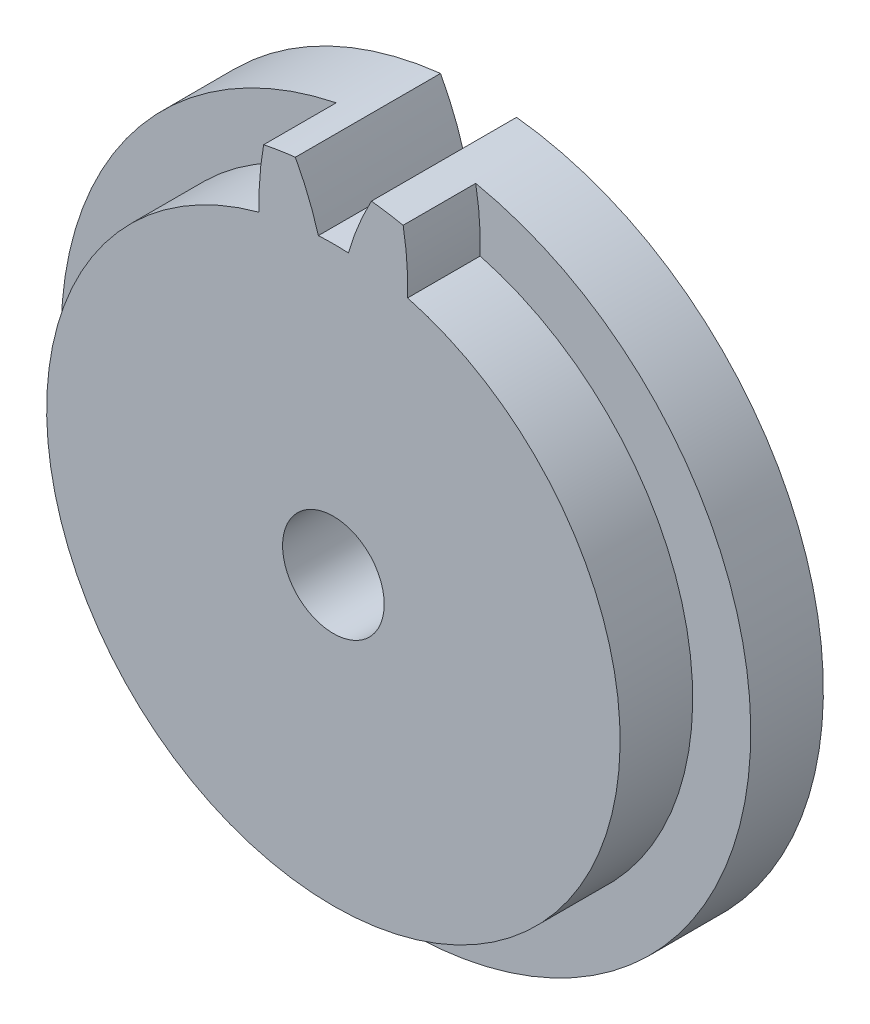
SolidWorks part; units mm, degrees
ref_plane "前基準面" through (0, 0, 0) normal (0, 0, 1) x (1, 0, 0)
ref_plane "上基準面" through (0, 0, 0) normal (0, 1, 0) x (1, 0, 0)
ref_plane "右基準面" through (0, 0, 0) normal (1, 0, 0) x (0, 0, -1)
sketch "草圖1" plane through (0, 0, 0) normal (0, 0, 1) x (1, 0, 0)
  line L0 (0, -15.5) -> (-7.8217, 33.8844) construction
  line L1 (0, -15.5) -> (7.8217, 33.8844) construction
  line L2 (0, -15.5) -> (0, 34.5) construction
  line L3 (0, -15.5) -> (-2.0673, 23.9459) construction
  line L4 (0, -15.5) -> (2.0673, 23.9459) construction
  line L5 (0, 47.5) -> (-6.8883, 30.8702) construction
  line L7 (0, 47.5) -> (6.8883, 30.8702) construction
  line L8 (0, 47.5) -> (-3.4455, 35.4842) construction
  line L9 (0, 47.5) -> (3.4455, 35.4842) construction
  line L10 (-1.625, 24.5) -> (1.625, 24.5)
  circle A0 centre (0, -15.5) radius 39.5
  circle A1 centre (0, -15.5) radius 45 construction
  arc A2 (-21.5968, 29.5952) -> (-23.7885, 28.4785) centre (0, -15.5) ccw
  circle A3 centre (0, -15.5) radius 7
  arc A4 (-6.6046, 34.0619) -> (-2.0673, 23.9459) centre (-40.3648, 12.8439) cw
  arc A5 (6.6046, 34.0619) -> (2.0673, 23.9459) centre (40.3648, 12.8439) ccw
  circle A6 centre (0, 47.5) radius 5
  circle A7 centre (0, 47.5) radius 12.5
  circle A8 centre (0, 47.5) radius 18 construction
  arc A9 (-3.4455, 35.4842) -> (-1.625, 24.5) centre (29.8672, 35.3623) ccw
  arc A10 (3.4455, 35.4842) -> (1.625, 24.5) centre (-29.8672, 35.3623) cw
  arc A11 (-21.5968, 29.5952) -> (-14.1555, 21.3764) centre (-47.1479, -1.0167) cw
  arc A12 (-9.0341, 33.6771) -> (-10.2234, 22.6541) centre (29.6304, 23.93) ccw
  arc A13 (-34.475, 20.7143) -> (-24.8582, 15.1973) centre (-49.3159, -16.2951) cw
  arc A14 (-23.7885, 28.4785) -> (-21.5132, 17.6275) centre (15.9956, 31.1565) ccw
  arc A15 (-43.9785, 8.2885) -> (-33.1275, 6.0132) centre (-46.6565, -31.4956) cw
  arc A16 (-36.2143, 18.975) -> (-30.6973, 9.3582) centre (0.7951, 33.8159) ccw
  arc A17 (-49.1771, -6.4659) -> (-38.1541, -5.2766) centre (-39.43, -45.1304) cw
  arc A18 (-45.0952, 6.0968) -> (-36.8764, -1.3445) centre (-14.4833, 31.6479) ccw
  arc A19 (-49.5619, -22.1046) -> (-39.4459, -17.5673) centre (-28.3439, -55.8648) cw
  arc A20 (-49.5619, -8.8954) -> (-39.4459, -13.4327) centre (-28.3439, 24.8648) ccw
  arc A21 (-45.0952, -37.0968) -> (-36.8764, -29.6555) centre (-14.4833, -62.6479) cw
  arc A22 (-49.1771, -24.5341) -> (-38.1541, -25.7234) centre (-39.43, 14.1304) ccw
  arc A23 (-36.2143, -49.975) -> (-30.6973, -40.3582) centre (0.7951, -64.8159) cw
  arc A24 (-43.9785, -39.2885) -> (-33.1275, -37.0132) centre (-46.6565, 0.4956) ccw
  arc A25 (-23.7885, -59.4785) -> (-21.5132, -48.6275) centre (15.9956, -62.1565) cw
  arc A26 (-34.475, -51.7143) -> (-24.8582, -46.1973) centre (-49.3159, -14.7049) ccw
  arc A27 (-9.0341, -64.6771) -> (-10.2234, -53.6541) centre (29.6304, -54.93) cw
  arc A28 (-21.5968, -60.5952) -> (-14.1555, -52.3764) centre (-47.1479, -29.9833) ccw
  arc A29 (6.6046, -65.0619) -> (2.0673, -54.9459) centre (40.3648, -43.8439) cw
  arc A30 (-6.6046, -65.0619) -> (-2.0673, -54.9459) centre (-40.3648, -43.8439) ccw
  arc A31 (21.5968, -60.5952) -> (14.1555, -52.3764) centre (47.1479, -29.9833) cw
  arc A32 (9.0341, -64.6771) -> (10.2234, -53.6541) centre (-29.6304, -54.93) ccw
  arc A33 (34.475, -51.7143) -> (24.8582, -46.1973) centre (49.3159, -14.7049) cw
  arc A34 (23.7885, -59.4785) -> (21.5132, -48.6275) centre (-15.9956, -62.1565) ccw
  arc A35 (43.9785, -39.2885) -> (33.1275, -37.0132) centre (46.6565, 0.4956) cw
  arc A36 (36.2143, -49.975) -> (30.6973, -40.3582) centre (-0.7951, -64.8159) ccw
  arc A37 (49.1771, -24.5341) -> (38.1541, -25.7234) centre (39.43, 14.1304) cw
  arc A38 (45.0952, -37.0968) -> (36.8764, -29.6555) centre (14.4833, -62.6479) ccw
  arc A39 (49.5619, -8.8954) -> (39.4459, -13.4327) centre (28.3439, 24.8648) cw
  arc A40 (49.5619, -22.1046) -> (39.4459, -17.5673) centre (28.3439, -55.8648) ccw
  arc A41 (45.0952, 6.0968) -> (36.8764, -1.3445) centre (14.4833, 31.6479) cw
  arc A42 (49.1771, -6.4659) -> (38.1541, -5.2766) centre (39.43, -45.1304) ccw
  arc A43 (36.2143, 18.975) -> (30.6973, 9.3582) centre (-0.7951, 33.8159) cw
  arc A44 (43.9785, 8.2885) -> (33.1275, 6.0132) centre (46.6565, -31.4956) ccw
  arc A45 (23.7885, 28.4785) -> (21.5132, 17.6275) centre (-15.9956, 31.1565) cw
  arc A46 (34.475, 20.7143) -> (24.8582, 15.1973) centre (49.3159, -16.2951) ccw
  arc A47 (9.0341, 33.6771) -> (10.2234, 22.6541) centre (-29.6304, 23.93) cw
  arc A48 (21.5968, 29.5952) -> (14.1555, 21.3764) centre (47.1479, -1.0167) ccw
  arc A49 (-6.6046, 34.0619) -> (-9.0341, 33.6771) centre (0, -15.5) ccw
  arc A50 (9.0341, 33.6771) -> (6.6046, 34.0619) centre (0, -15.5) ccw
  arc A51 (23.7885, 28.4785) -> (21.5968, 29.5952) centre (0, -15.5) ccw
  arc A52 (36.2143, 18.975) -> (34.475, 20.7143) centre (0, -15.5) ccw
  arc A53 (45.0952, 6.0968) -> (43.9785, 8.2885) centre (0, -15.5) ccw
  arc A54 (49.5619, -8.8954) -> (49.1771, -6.4659) centre (0, -15.5) ccw
  arc A55 (49.1771, -24.5341) -> (49.5619, -22.1046) centre (0, -15.5) ccw
  arc A56 (43.9785, -39.2885) -> (45.0952, -37.0968) centre (0, -15.5) ccw
  arc A57 (34.475, -51.7143) -> (36.2143, -49.975) centre (0, -15.5) ccw
  arc A58 (21.5968, -60.5952) -> (23.7885, -59.4785) centre (0, -15.5) ccw
  arc A59 (6.6046, -65.0619) -> (9.0341, -64.6771) centre (0, -15.5) ccw
  arc A60 (-9.0341, -64.6771) -> (-6.6046, -65.0619) centre (0, -15.5) ccw
  arc A61 (-23.7885, -59.4785) -> (-21.5968, -60.5952) centre (0, -15.5) ccw
  arc A62 (-36.2143, -49.975) -> (-34.475, -51.7143) centre (0, -15.5) ccw
  arc A63 (-45.0952, -37.0968) -> (-43.9785, -39.2885) centre (0, -15.5) ccw
  arc A64 (-49.5619, -22.1046) -> (-49.1771, -24.5341) centre (0, -15.5) ccw
  arc A65 (-49.1771, -6.4659) -> (-49.5619, -8.8954) centre (0, -15.5) ccw
  arc A66 (-34.475, 20.7143) -> (-36.2143, 18.975) centre (0, -15.5) ccw
  arc A67 (-43.9785, 8.2885) -> (-45.0952, 6.0968) centre (0, -15.5) ccw
  point P18 (0, 24.5)
  point P144 (0, -15.5)
  dimension "D1" = 79
  dimension "D2" = 90
  dimension "D3" = 100
  dimension "D6" = 14
  dimension "D9" = 25
  dimension "D10" = 10
  dimension "D15" = 33.3129
  dimension "D16" = 39.8742
  dimension "D4" = 18
  dimension "D5" = 6
  dimension "D7" = 1.23
  dimension "D8" = 63
  dimension "D11" = 45
  dimension "D12" = 32
  dimension "D13" = 3.25
  dimension "D14" = 23
  dimension "D17" = 20
extrude "填料-伸長1" add sketch "草圖1" along normal blind 10 contours A0 A3 | A13 A66 A16 A0 | A2 A14 A0 A11 | A4 A49 A12 A0 | A47 A50 A5 A0 | A45 A51 A48 A0 | A43 A52 A46 A0 | A41 A53 A44 A0 | A39 A54 A42 A0 | A37 A55 A40 A0 | A35 A56 A38 A0 | A33 A57 A36 A0 | A31 A58 A34 A0 | A29 A59 A32 A0 | A27 A60 A30 A0 | A25 A61 A28 A0 | A23 A62 A26 A0 | A21 A63 A24 A0 | A19 A64 A22 A0 | A17 A65 A20 A0 | A15 A67 A18 A0
sketch "草圖2" plane through (0, 0, 0) normal (0, 0, 1) x (1, 0, 0)
  arc A0 (6.6046, 34.0619) -> (2.0673, 23.9459) centre (40.3648, 12.8439) ccw construction
  arc A1 (2.0673, 23.9459) -> (-2.0673, 23.9459) centre (0, -15.5) ccw construction
  arc A2 (-2.0673, 23.9459) -> (-6.6046, 34.0619) centre (-40.3648, 12.8439) ccw construction
  arc A3 (6.6046, 34.0619) -> (2.0673, 23.9459) centre (40.3648, 12.8439) ccw
  arc A4 (2.0673, 23.9459) -> (-2.0673, 23.9459) centre (0, -15.5) ccw
  arc A5 (-2.0673, 23.9459) -> (-6.6046, 34.0619) centre (-40.3648, 12.8439) ccw
  arc A6 (-6.6046, 34.0619) -> (6.6046, 34.0619) centre (0, -15.5) ccw
  circle A7 centre (0, -15.5) radius 7 construction
  circle A8 centre (0, -15.5) radius 7
extrude "填料-伸長2" add sketch "草圖2" against normal blind 10
sketch "草圖3" plane through (0, 0, 0) normal (0, 0, 1) x (1, 0, 0)
  circle A0 centre (0, -15.5) radius 39.5
  arc A80 (39.4459, -17.5673) -> (39.4459, -13.4327) centre (0, -15.5) ccw
  arc A81 (39.4459, -13.4327) -> (49.5619, -8.8954) centre (28.3439, 24.8648) ccw
  arc A82 (49.5619, -8.8954) -> (49.1771, -6.4659) centre (0, -15.5) ccw
  arc A83 (49.1771, -6.4659) -> (38.1541, -5.2766) centre (39.43, -45.1304) ccw
  arc A84 (38.1541, -5.2766) -> (36.8764, -1.3445) centre (0, -15.5) ccw
  arc A85 (36.8764, -1.3445) -> (45.0952, 6.0968) centre (14.4833, 31.6479) ccw
  arc A86 (45.0952, 6.0968) -> (43.9785, 8.2885) centre (0, -15.5) ccw
  arc A87 (43.9785, 8.2885) -> (33.1275, 6.0132) centre (46.6565, -31.4956) ccw
  arc A88 (33.1275, 6.0132) -> (30.6973, 9.3582) centre (0, -15.5) ccw
  arc A89 (30.6973, 9.3582) -> (36.2143, 18.975) centre (-0.7951, 33.8159) ccw
  arc A90 (36.2143, 18.975) -> (34.475, 20.7143) centre (0, -15.5) ccw
  arc A91 (34.475, 20.7143) -> (24.8582, 15.1973) centre (49.3159, -16.2951) ccw
  arc A92 (24.8582, 15.1973) -> (21.5132, 17.6275) centre (0, -15.5) ccw
  arc A93 (21.5132, 17.6275) -> (23.7885, 28.4785) centre (-15.9956, 31.1565) ccw
  arc A94 (23.7885, 28.4785) -> (21.5968, 29.5952) centre (0, -15.5) ccw
  arc A95 (21.5968, 29.5952) -> (14.1555, 21.3764) centre (47.1479, -1.0167) ccw
  arc A96 (14.1555, 21.3764) -> (10.2234, 22.6541) centre (0, -15.5) ccw
  arc A97 (10.2234, 22.6541) -> (9.0341, 33.6771) centre (-29.6304, 23.93) ccw
  arc A98 (9.0341, 33.6771) -> (6.6046, 34.0619) centre (0, -15.5) ccw
  arc A99 (6.6046, 34.0619) -> (2.0673, 23.9459) centre (40.3648, 12.8439) ccw
  arc A100 (2.0673, 23.9459) -> (-2.0673, 23.9459) centre (0, -15.5) ccw
  arc A101 (-2.0673, 23.9459) -> (-6.6046, 34.0619) centre (-40.3648, 12.8439) ccw
  arc A102 (-6.6046, 34.0619) -> (-9.0341, 33.6771) centre (0, -15.5) ccw
  arc A103 (-9.0341, 33.6771) -> (-10.2234, 22.6541) centre (29.6304, 23.93) ccw
  arc A104 (-10.2234, 22.6541) -> (-14.1555, 21.3764) centre (0, -15.5) ccw
  arc A105 (-14.1555, 21.3764) -> (-21.5968, 29.5952) centre (-47.1479, -1.0167) ccw
  arc A106 (-21.5968, 29.5952) -> (-23.7885, 28.4785) centre (0, -15.5) ccw
  arc A107 (-23.7885, 28.4785) -> (-21.5132, 17.6275) centre (15.9956, 31.1565) ccw
  arc A108 (-21.5132, 17.6275) -> (-24.8582, 15.1973) centre (0, -15.5) ccw
  arc A109 (-24.8582, 15.1973) -> (-34.475, 20.7143) centre (-49.3159, -16.2951) ccw
  arc A110 (-34.475, 20.7143) -> (-36.2143, 18.975) centre (0, -15.5) ccw
  arc A111 (-36.2143, 18.975) -> (-30.6973, 9.3582) centre (0.7951, 33.8159) ccw
  arc A112 (-30.6973, 9.3582) -> (-33.1275, 6.0132) centre (0, -15.5) ccw
  arc A113 (-33.1275, 6.0132) -> (-43.9785, 8.2885) centre (-46.6565, -31.4956) ccw
  arc A114 (-43.9785, 8.2885) -> (-45.0952, 6.0968) centre (0, -15.5) ccw
  arc A115 (-45.0952, 6.0968) -> (-36.8764, -1.3445) centre (-14.4833, 31.6479) ccw
  arc A116 (-36.8764, -1.3445) -> (-38.1541, -5.2766) centre (0, -15.5) ccw
  arc A117 (-38.1541, -5.2766) -> (-49.1771, -6.4659) centre (-39.43, -45.1304) ccw
  arc A118 (-49.1771, -6.4659) -> (-49.5619, -8.8954) centre (0, -15.5) ccw
  arc A119 (-49.5619, -8.8954) -> (-39.4459, -13.4327) centre (-28.3439, 24.8648) ccw
  arc A120 (-39.4459, -13.4327) -> (-39.4459, -17.5673) centre (0, -15.5) ccw
  arc A121 (-39.4459, -17.5673) -> (-49.5619, -22.1046) centre (-28.3439, -55.8648) ccw
  arc A122 (-49.5619, -22.1046) -> (-49.1771, -24.5341) centre (0, -15.5) ccw
  arc A123 (-49.1771, -24.5341) -> (-38.1541, -25.7234) centre (-39.43, 14.1304) ccw
  arc A124 (-38.1541, -25.7234) -> (-36.8764, -29.6555) centre (0, -15.5) ccw
  arc A125 (-36.8764, -29.6555) -> (-45.0952, -37.0968) centre (-14.4833, -62.6479) ccw
  arc A126 (-45.0952, -37.0968) -> (-43.9785, -39.2885) centre (0, -15.5) ccw
  arc A127 (-43.9785, -39.2885) -> (-33.1275, -37.0132) centre (-46.6565, 0.4956) ccw
  arc A128 (-33.1275, -37.0132) -> (-30.6973, -40.3582) centre (0, -15.5) ccw
  arc A129 (-30.6973, -40.3582) -> (-36.2143, -49.975) centre (0.7951, -64.8159) ccw
  arc A130 (-36.2143, -49.975) -> (-34.475, -51.7143) centre (0, -15.5) ccw
  arc A131 (-34.475, -51.7143) -> (-24.8582, -46.1973) centre (-49.3159, -14.7049) ccw
  arc A132 (-24.8582, -46.1973) -> (-21.5132, -48.6275) centre (0, -15.5) ccw
  arc A133 (-21.5132, -48.6275) -> (-23.7885, -59.4785) centre (15.9956, -62.1565) ccw
  arc A134 (-23.7885, -59.4785) -> (-21.5968, -60.5952) centre (0, -15.5) ccw
  arc A135 (-21.5968, -60.5952) -> (-14.1555, -52.3764) centre (-47.1479, -29.9833) ccw
  arc A136 (-14.1555, -52.3764) -> (-10.2234, -53.6541) centre (0, -15.5) ccw
  arc A137 (-10.2234, -53.6541) -> (-9.0341, -64.6771) centre (29.6304, -54.93) ccw
  arc A138 (-9.0341, -64.6771) -> (-6.6046, -65.0619) centre (0, -15.5) ccw
  arc A139 (-6.6046, -65.0619) -> (-2.0673, -54.9459) centre (-40.3648, -43.8439) ccw
  arc A140 (-2.0673, -54.9459) -> (2.0673, -54.9459) centre (0, -15.5) ccw
  arc A141 (2.0673, -54.9459) -> (6.6046, -65.0619) centre (40.3648, -43.8439) ccw
  arc A142 (6.6046, -65.0619) -> (9.0341, -64.6771) centre (0, -15.5) ccw
  arc A143 (9.0341, -64.6771) -> (10.2234, -53.6541) centre (-29.6304, -54.93) ccw
  arc A144 (10.2234, -53.6541) -> (14.1555, -52.3764) centre (0, -15.5) ccw
  arc A145 (14.1555, -52.3764) -> (21.5968, -60.5952) centre (47.1479, -29.9833) ccw
  arc A146 (21.5968, -60.5952) -> (23.7885, -59.4785) centre (0, -15.5) ccw
  arc A147 (23.7885, -59.4785) -> (21.5132, -48.6275) centre (-15.9956, -62.1565) ccw
  arc A148 (21.5132, -48.6275) -> (24.8582, -46.1973) centre (0, -15.5) ccw
  arc A149 (24.8582, -46.1973) -> (34.475, -51.7143) centre (49.3159, -14.7049) ccw
  arc A150 (34.475, -51.7143) -> (36.2143, -49.975) centre (0, -15.5) ccw
  arc A151 (36.2143, -49.975) -> (30.6973, -40.3582) centre (-0.7951, -64.8159) ccw
  arc A152 (30.6973, -40.3582) -> (33.1275, -37.0132) centre (0, -15.5) ccw
  arc A153 (33.1275, -37.0132) -> (43.9785, -39.2885) centre (46.6565, 0.4956) ccw
  arc A154 (43.9785, -39.2885) -> (45.0952, -37.0968) centre (0, -15.5) ccw
  arc A155 (45.0952, -37.0968) -> (36.8764, -29.6555) centre (14.4833, -62.6479) ccw
  arc A156 (36.8764, -29.6555) -> (38.1541, -25.7234) centre (0, -15.5) ccw
  arc A157 (38.1541, -25.7234) -> (49.1771, -24.5341) centre (39.43, 14.1304) ccw
  arc A158 (49.1771, -24.5341) -> (49.5619, -22.1046) centre (0, -15.5) ccw
  arc A159 (49.5619, -22.1046) -> (39.4459, -17.5673) centre (28.3439, -55.8648) ccw
  arc A160 (39.4459, -17.5673) -> (39.4459, -13.4327) centre (0, -15.5) ccw
  arc A161 (39.4459, -13.4327) -> (49.5619, -8.8954) centre (28.3439, 24.8648) ccw
  arc A162 (49.5619, -8.8954) -> (49.1771, -6.4659) centre (0, -15.5) ccw
  arc A163 (49.1771, -6.4659) -> (38.1541, -5.2766) centre (39.43, -45.1304) ccw
  arc A164 (38.1541, -5.2766) -> (36.8764, -1.3445) centre (0, -15.5) ccw
  arc A165 (36.8764, -1.3445) -> (45.0952, 6.0968) centre (14.4833, 31.6479) ccw
  arc A166 (45.0952, 6.0968) -> (43.9785, 8.2885) centre (0, -15.5) ccw
  arc A167 (43.9785, 8.2885) -> (33.1275, 6.0132) centre (46.6565, -31.4956) ccw
  arc A168 (33.1275, 6.0132) -> (30.6973, 9.3582) centre (0, -15.5) ccw
  arc A169 (30.6973, 9.3582) -> (36.2143, 18.975) centre (-0.7951, 33.8159) ccw
  arc A170 (36.2143, 18.975) -> (34.475, 20.7143) centre (0, -15.5) ccw
  arc A171 (34.475, 20.7143) -> (24.8582, 15.1973) centre (49.3159, -16.2951) ccw
  arc A172 (24.8582, 15.1973) -> (21.5132, 17.6275) centre (0, -15.5) ccw
  arc A173 (21.5132, 17.6275) -> (23.7885, 28.4785) centre (-15.9956, 31.1565) ccw
  arc A174 (23.7885, 28.4785) -> (21.5968, 29.5952) centre (0, -15.5) ccw
  arc A175 (21.5968, 29.5952) -> (14.1555, 21.3764) centre (47.1479, -1.0167) ccw
  arc A176 (14.1555, 21.3764) -> (10.2234, 22.6541) centre (0, -15.5) ccw
  arc A184 (-10.2234, 22.6541) -> (-14.1555, 21.3764) centre (0, -15.5) ccw
  arc A185 (-14.1555, 21.3764) -> (-21.5968, 29.5952) centre (-47.1479, -1.0167) ccw
  arc A186 (-21.5968, 29.5952) -> (-23.7885, 28.4785) centre (0, -15.5) ccw
  arc A187 (-23.7885, 28.4785) -> (-21.5132, 17.6275) centre (15.9956, 31.1565) ccw
  arc A188 (-21.5132, 17.6275) -> (-24.8582, 15.1973) centre (0, -15.5) ccw
  arc A189 (-24.8582, 15.1973) -> (-34.475, 20.7143) centre (-49.3159, -16.2951) ccw
  arc A190 (-34.475, 20.7143) -> (-36.2143, 18.975) centre (0, -15.5) ccw
  arc A191 (-36.2143, 18.975) -> (-30.6973, 9.3582) centre (0.7951, 33.8159) ccw
  arc A192 (-30.6973, 9.3582) -> (-33.1275, 6.0132) centre (0, -15.5) ccw
  arc A193 (-33.1275, 6.0132) -> (-43.9785, 8.2885) centre (-46.6565, -31.4956) ccw
  arc A194 (-43.9785, 8.2885) -> (-45.0952, 6.0968) centre (0, -15.5) ccw
  arc A195 (-45.0952, 6.0968) -> (-36.8764, -1.3445) centre (-14.4833, 31.6479) ccw
  arc A196 (-36.8764, -1.3445) -> (-38.1541, -5.2766) centre (0, -15.5) ccw
  arc A197 (-38.1541, -5.2766) -> (-49.1771, -6.4659) centre (-39.43, -45.1304) ccw
  arc A198 (-49.1771, -6.4659) -> (-49.5619, -8.8954) centre (0, -15.5) ccw
  arc A199 (-49.5619, -8.8954) -> (-39.4459, -13.4327) centre (-28.3439, 24.8648) ccw
  arc A200 (-39.4459, -13.4327) -> (-39.4459, -17.5673) centre (0, -15.5) ccw
  arc A201 (-39.4459, -17.5673) -> (-49.5619, -22.1046) centre (-28.3439, -55.8648) ccw
  arc A202 (-49.5619, -22.1046) -> (-49.1771, -24.5341) centre (0, -15.5) ccw
  arc A203 (-49.1771, -24.5341) -> (-38.1541, -25.7234) centre (-39.43, 14.1304) ccw
  arc A204 (-38.1541, -25.7234) -> (-36.8764, -29.6555) centre (0, -15.5) ccw
  arc A205 (-36.8764, -29.6555) -> (-45.0952, -37.0968) centre (-14.4833, -62.6479) ccw
  arc A206 (-45.0952, -37.0968) -> (-43.9785, -39.2885) centre (0, -15.5) ccw
  arc A207 (-43.9785, -39.2885) -> (-33.1275, -37.0132) centre (-46.6565, 0.4956) ccw
  arc A208 (-33.1275, -37.0132) -> (-30.6973, -40.3582) centre (0, -15.5) ccw
  arc A209 (-30.6973, -40.3582) -> (-36.2143, -49.975) centre (0.7951, -64.8159) ccw
  arc A210 (-36.2143, -49.975) -> (-34.475, -51.7143) centre (0, -15.5) ccw
  arc A211 (-34.475, -51.7143) -> (-24.8582, -46.1973) centre (-49.3159, -14.7049) ccw
  arc A212 (-24.8582, -46.1973) -> (-21.5132, -48.6275) centre (0, -15.5) ccw
  arc A213 (-21.5132, -48.6275) -> (-23.7885, -59.4785) centre (15.9956, -62.1565) ccw
  arc A214 (-23.7885, -59.4785) -> (-21.5968, -60.5952) centre (0, -15.5) ccw
  arc A215 (-21.5968, -60.5952) -> (-14.1555, -52.3764) centre (-47.1479, -29.9833) ccw
  arc A216 (-14.1555, -52.3764) -> (-10.2234, -53.6541) centre (0, -15.5) ccw
  arc A217 (-10.2234, -53.6541) -> (-9.0341, -64.6771) centre (29.6304, -54.93) ccw
  arc A218 (-9.0341, -64.6771) -> (-6.6046, -65.0619) centre (0, -15.5) ccw
  arc A219 (-6.6046, -65.0619) -> (-2.0673, -54.9459) centre (-40.3648, -43.8439) ccw
  arc A220 (-2.0673, -54.9459) -> (2.0673, -54.9459) centre (0, -15.5) ccw
  arc A221 (2.0673, -54.9459) -> (6.6046, -65.0619) centre (40.3648, -43.8439) ccw
  arc A222 (6.6046, -65.0619) -> (9.0341, -64.6771) centre (0, -15.5) ccw
  arc A223 (9.0341, -64.6771) -> (10.2234, -53.6541) centre (-29.6304, -54.93) ccw
  arc A224 (10.2234, -53.6541) -> (14.1555, -52.3764) centre (0, -15.5) ccw
  arc A225 (14.1555, -52.3764) -> (21.5968, -60.5952) centre (47.1479, -29.9833) ccw
  arc A226 (21.5968, -60.5952) -> (23.7885, -59.4785) centre (0, -15.5) ccw
  arc A227 (23.7885, -59.4785) -> (21.5132, -48.6275) centre (-15.9956, -62.1565) ccw
  arc A228 (21.5132, -48.6275) -> (24.8582, -46.1973) centre (0, -15.5) ccw
  arc A229 (24.8582, -46.1973) -> (34.475, -51.7143) centre (49.3159, -14.7049) ccw
  arc A230 (34.475, -51.7143) -> (36.2143, -49.975) centre (0, -15.5) ccw
  arc A231 (36.2143, -49.975) -> (30.6973, -40.3582) centre (-0.7951, -64.8159) ccw
  arc A232 (30.6973, -40.3582) -> (33.1275, -37.0132) centre (0, -15.5) ccw
  arc A233 (33.1275, -37.0132) -> (43.9785, -39.2885) centre (46.6565, 0.4956) ccw
  arc A234 (43.9785, -39.2885) -> (45.0952, -37.0968) centre (0, -15.5) ccw
  arc A235 (45.0952, -37.0968) -> (36.8764, -29.6555) centre (14.4833, -62.6479) ccw
  arc A236 (36.8764, -29.6555) -> (38.1541, -25.7234) centre (0, -15.5) ccw
  arc A237 (38.1541, -25.7234) -> (49.1771, -24.5341) centre (39.43, 14.1304) ccw
  arc A238 (49.1771, -24.5341) -> (49.5619, -22.1046) centre (0, -15.5) ccw
  arc A239 (49.5619, -22.1046) -> (39.4459, -17.5673) centre (28.3439, -55.8648) ccw
  dimension "D1" = 0
extrude "除料-伸長1" cut sketch "草圖3" along normal blind 10 contours A174 A175 A0 A173 | A170 A171 A0 A169 | A166 A167 A0 A165 | A162 A163 A0 A161 | A238 A239 A0 A237 | A234 A235 A0 A233 | A230 A231 A0 A229 | A226 A227 A0 A225 | A222 A223 A0 A221 | A218 A219 A0 A217 | A214 A215 A0 A213 | A210 A211 A0 A209 | A206 A207 A0 A205 | A202 A203 A0 A201 | A198 A199 A0 A197 | A194 A195 A0 A193 | A190 A191 A0 A189 | A186 A187 A0 A185
sketch "草圖4" plane through (0, 0, 0) normal (0, 0, 1) x (1, 0, 0)
  circle A0 centre (0, -15.5) radius 47.5
  circle A1 centre (0, -15.5) radius 62.5
  dimension "D1" = 95
  dimension "D2" = 125
extrude "除料-伸長2" cut sketch "草圖4" against normal through all both and the other way through all
sketch "草圖6" plane through (0, 0, 0) normal (1, 0, 0) x (0, 0, -1)
  line L0 (10, -22.5) -> (10, -8.5) construction
  line L1 (-10, -8.5) -> (-10, -22.5) construction
  line L2 (10, -22.5) -> (10, -8.5)
  line L3 (-10, -8.5) -> (-10, -22.5)
  line L4 (-10, -15.5) -> (10, -15.5) construction
  point P6 (0, 0)
